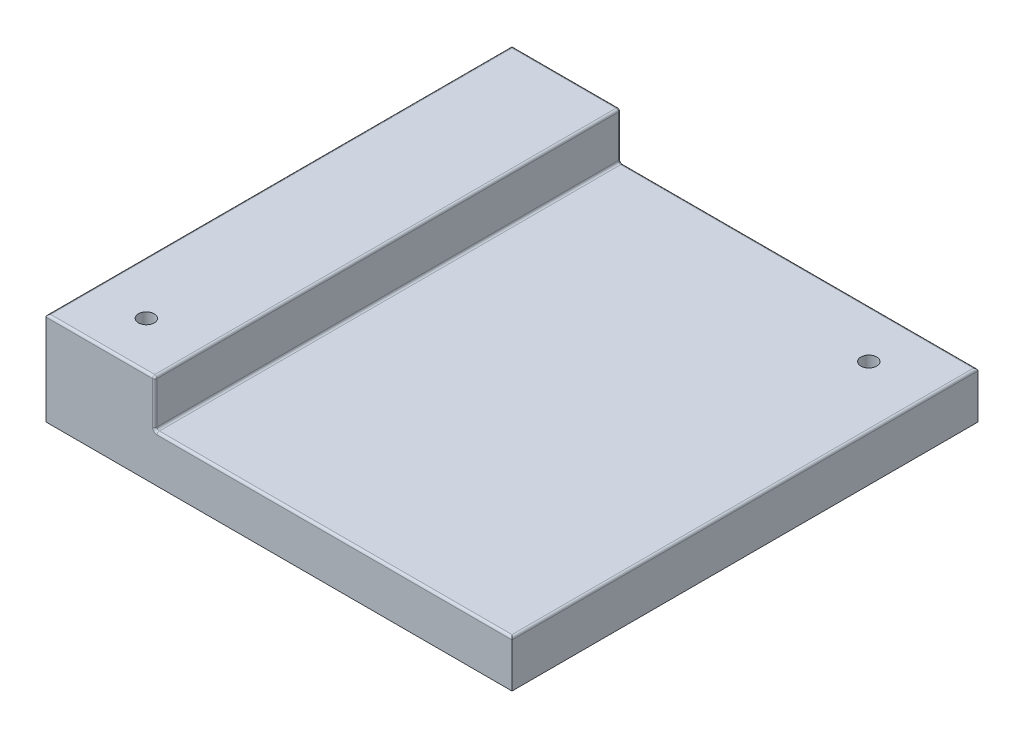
SolidWorks part; units mm, degrees
ref_plane "Front Plane" through (0, 0, 0) normal (0, 0, 1) x (1, 0, 0)
ref_plane "Top Plane" through (0, 0, 0) normal (0, 1, 0) x (1, 0, 0)
ref_plane "Right Plane" through (0, 0, 0) normal (1, 0, 0) x (0, 0, -1)
sketch "Sketch1" plane through (0, 0, 0) normal (0, 0, 1) x (1, 0, 0)
  line L0 (0, 0) -> (0, 304.8)
  line L1 (0, 304.8) -> (355.6, 304.8)
  line L2 (355.6, 304.8) -> (355.6, 152.4)
  line L3 (355.6, 152.4) -> (1524, 152.4)
  line L4 (1524, 152.4) -> (1524, 0)
  line L5 (1524, 0) -> (0, 0)
  dimension "D1" = 304.8
  dimension "D2" = 1524
  dimension "D3" = 355.6
extrude "Extrude1" add sketch "Sketch1" along normal mid plane 1524
fillet "Fillet1" radius 7.62 10 edges at (1524, 152.4, 0) (939.8, 152.4, 762) (939.8, 152.4, -762) (355.6, 152.4, 0) (355.6, 228.6, 762) (355.6, 228.6, -762) (355.6, 304.8, 0) (177.8, 304.8, 762) (0, 304.8, 0) (177.8, 304.8, -762)
shell "Shell1" thickness 38.1
sketch "Sketch2" plane through (0, 304.8, 0) normal (0, 1, 0) x (1, 0, 0)
  circle A0 centre (175.2482, -609.0218) radius 25.8977
  circle A1 centre (1326.496, 602.3128) radius 25.8977
extrude "Cut-Extrude1" cut sketch "Sketch2" against normal through all
